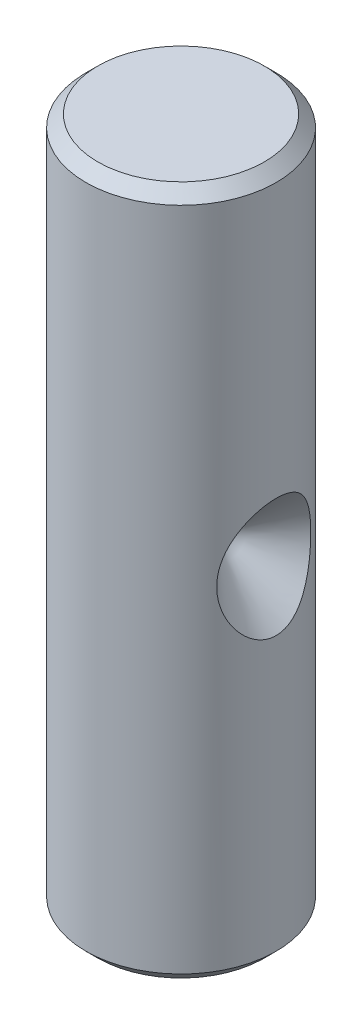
SolidWorks part; units mm, degrees
ref_plane "Plan de face" through (0, 0, 0) normal (0, 0, 1) x (1, 0, 0)
ref_plane "Plan de dessus" through (0, 0, 0) normal (0, 1, 0) x (1, 0, 0)
ref_plane "Plan de droite" through (0, 0, 0) normal (1, 0, 0) x (0, 0, -1)
sketch "Esquisse1" plane through (0, 0, 0) normal (0, 1, 0) x (1, 0, 0)
  circle A0 centre (0, 0) radius 4
  dimension "D1" = 8
extrude "Extrusion1" add sketch "Esquisse1" along normal blind 29
chamfer "Chanfrein1" distance 0.5 angle 45 2 edges at (0, 0, 4) (0, 29, 4)
sketch "Esquisse3" plane through (0, 0, 0) normal (0, 0, 1) x (1, 0, 0)
  line L0 (6.7518, 14.5) -> (0.2196, 14.5) construction
  line L1 (3.5, 29) -> (-3.5, 29) construction
  line L2 (1.5, 14.5) -> (9.3022, 22.3022)
  line L3 (9.3022, 22.3022) -> (9.3022, 14.5)
  line L4 (4, 0.5) -> (4, 28.5) construction
  line L5 (1.5, 14.5) -> (9.3022, 14.5)
  dimension "D1" = 14.5
  dimension "D2" = 2.5
  dimension "D3" = 45
revolve "Enlèvement de matière-Révolution7" cut sketch "Esquisse3" angle 360 about L0
